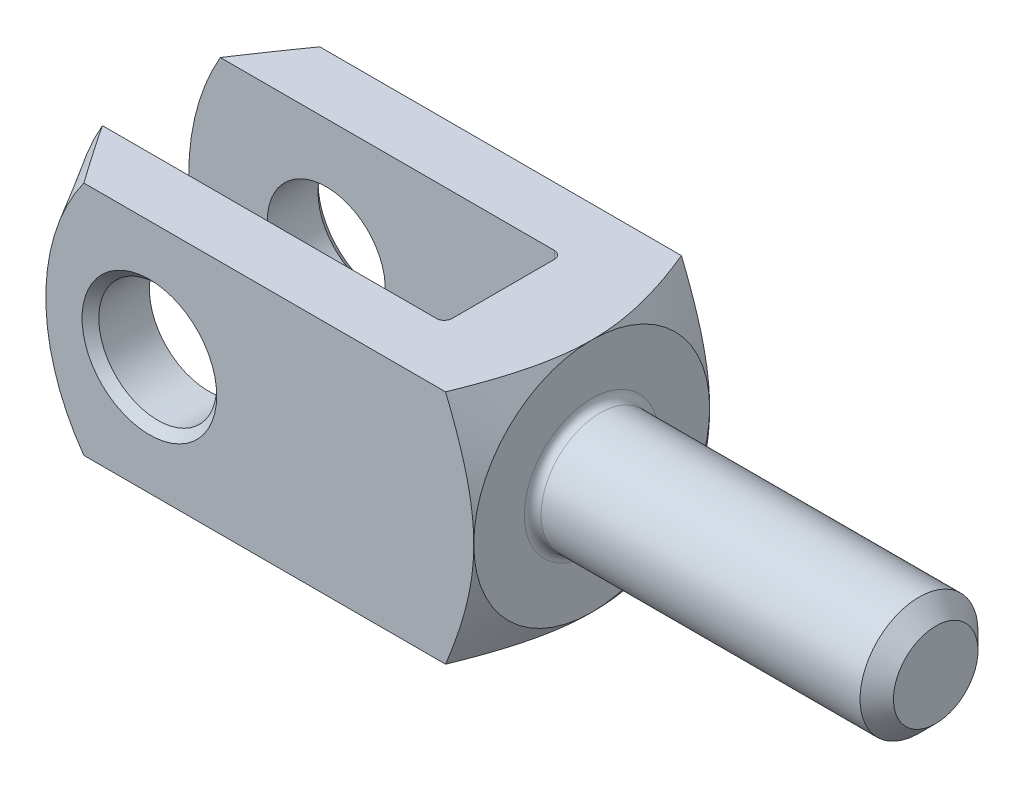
SolidWorks part; units mm, degrees
ref_plane "Front Plane" through (0, 0, 0) normal (0, 0, 1) x (1, 0, 0)
ref_plane "Top Plane" through (0, 0, 0) normal (0, 1, 0) x (1, 0, 0)
ref_plane "Right Plane" through (0, 0, 0) normal (1, 0, 0) x (0, 0, -1)
sketch "Sketch1" plane through (0, 0, 0) normal (1, 0, 0) x (0, 0, -1)
  line L0 (0, 0) -> (0, 50000) construction
  line L1 (0, 0) -> (50000, 0) construction
  line L2 (-12, -12) -> (-12, 12)
  line L3 (-12, 12) -> (12, 12)
  line L4 (12, -12) -> (12, 12)
  line L5 (-12, -12) -> (12, -12)
  point P9 (0, 12)
  point P11 (12, 0)
  point P12 (-12, 0)
  dimension "D1" = 24
  dimension "D2" = 24
extrude "Extrude1" add sketch "Sketch1" against normal blind 82
sketch "Sketch2" plane through (0, 0, 0) normal (1, 0, 0) x (0, 0, -1)
  circle A0 centre (0, 0) radius 6
  circle A1 centre (0, 0) radius 24
  dimension "D1" = 12
  dimension "D2" = 48
extrude "Extrude2" cut sketch "Sketch2" against normal blind 35
sketch "Sketch3" plane through (0, 0, 12) normal (0, 0, 1) x (1, 0, 0)
  circle A0 centre (-68, 0) radius 6
  dimension "D1" = 12
  dimension "D2" = 68
extrude "Extrude3" cut sketch "Sketch3" against normal through all
sketch "Sketch4" plane through (0, 12, 0) normal (0, 1, 0) x (1, 0, 0)
  line L0 (0, 0) -> (-50000, 0) construction
  line L1 (-82, -6) -> (-82, 6)
  line L2 (-82, 12) -> (-82, -12) construction
  line L3 (-82, 6) -> (-44, 6)
  line L4 (-44, 6) -> (-44, -6)
  line L5 (-68, 12) -> (-68, -12) construction
  line L6 (-82, -6) -> (-44, -6)
  point P7 (-68, 0)
  point P13 (-44, 0)
  point P14 (-82, 0)
  dimension "D1" = 24
  dimension "D2" = 12
extrude "Extrude4" cut sketch "Sketch4" against normal through all
fillet "Fillet1" radius 0.8 2 edges at (-44, 0, 6) (-44, 0, -6)
fillet "Fillet2" radius 0.85 1 edges at (-35, 0, -6)
chamfer "Chamfer2" distance 0.85 angle 45 2 edges at (-62, 0, -12) (-62, 0, 12)
sketch "Sketch6" plane through (0, 0, 0) normal (0, 0, 1) x (1, 0, 0)
  line L0 (-35, -12) -> (-35, -24)
  line L1 (-35, -24) -> (-41.9282, -24)
  line L2 (-41.9282, -24) -> (-35, -12)
  dimension "D1" = 30
  dimension "D2" = 24
revolve "Cut-Revolve1" cut sketch "Sketch6" angle 360 about axis through (-35, 0, 0) along (1, 0, 0)
sketch "Sketch7" plane through (0, 0, 0) normal (0, 1, 0) x (1, 0, 0)
  line L0 (-78.5359, -12) -> (-82, -6)
  line L1 (-82, 6) -> (-78.5359, 12)
  line L2 (-78.5359, 12) -> (-106, 12)
  line L3 (-82, 6) -> (-82, -6)
  line L4 (-106, 12) -> (-106, -12)
  line L5 (-106, -12) -> (-78.5359, -12)
  line L6 (-82, 12) -> (-37.8698, 12) construction
  line L7 (-82, -12) -> (-37.8698, -12) construction
  line L8 (-58, 0.6162) -> (-58, 50000.6162) construction
  dimension "D1" = 120
  dimension "D2" = 24
  dimension "D3" = 24
revolve "Cut-Revolve2" cut sketch "Sketch7" angle 180 about L8
chamfer "Chamfer3" distance 1.7 angle 45 1 edges at (0, 0, -6)
equation "\"D2@Sketch1\" = \"D1@Sketch1\""
equation "\"D2@Sketch2\" = \"D1@Sketch1\"/.5"
equation "\"D2@Sketch6\" = \"D1@Sketch1\""
equation "\"D2@Sketch7\" = \"D1@Sketch1\""
equation "\"D3@Sketch7\" = \"D1@Sketch1\""
